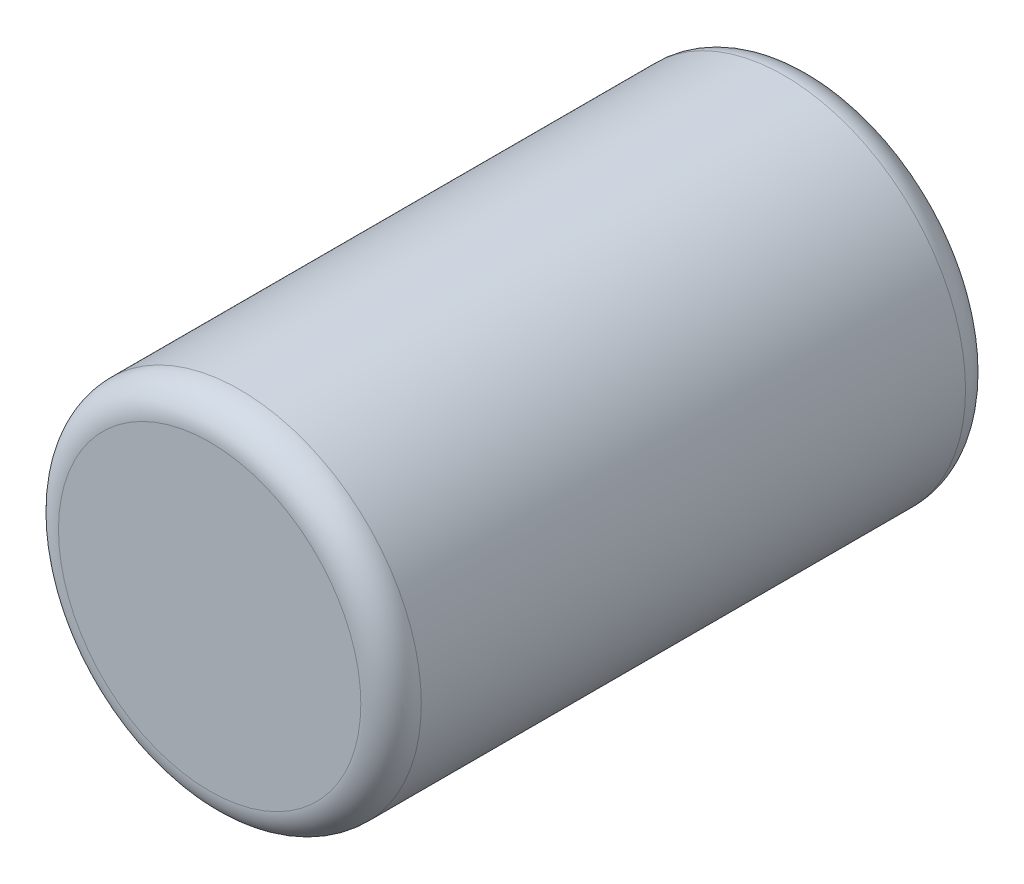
SolidWorks part; units mm, degrees
ref_plane "Спереди" through (0, 0, 0) normal (0, 0, 1) x (1, 0, 0)
ref_plane "Сверху" through (0, 0, 0) normal (0, 1, 0) x (1, 0, 0)
ref_plane "Справа" through (0, 0, 0) normal (1, 0, 0) x (0, 0, -1)
sketch "Эскиз1" plane through (0, 0, 0) normal (0, 0, 1) x (1, 0, 0)
  circle A0 centre (0, 0) radius 3
  dimension "D1" = 6
extrude "Бобышка-Вытянуть1" add sketch "Эскиз1" along normal mid plane 10
fillet "Скругление1" radius 0.5 2 edges at (3, 0, -5) (3, 0, 5)
